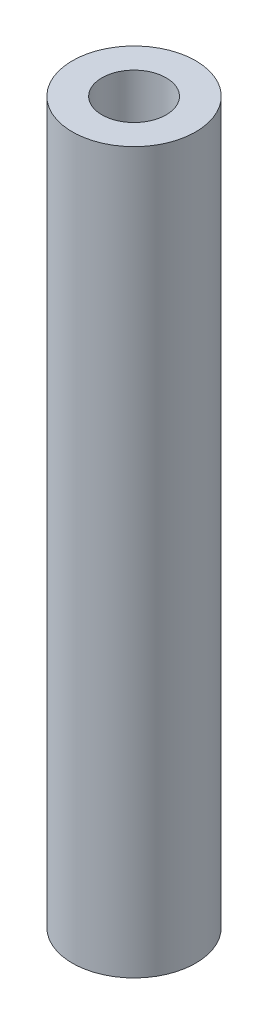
SolidWorks part; units mm, degrees
ref_plane "Front Plane" through (0, 0, 0) normal (0, 0, 1) x (1, 0, 0)
ref_plane "Top Plane" through (0, 0, 0) normal (0, 1, 0) x (1, 0, 0)
ref_plane "Right Plane" through (0, 0, 0) normal (1, 0, 0) x (0, 0, -1)
sketch "Sketch1" plane through (0, 0, 0) normal (0, 1, 0) x (1, 0, 0)
  circle A0 centre (0, 0) radius 2.4812
  circle A1 centre (0, 0) radius 4.7625
  dimension "D1" = 4.9625
  dimension "D2" = 9.525
extrude "Boss-Extrude1" add sketch "Sketch1" along normal blind 55.59
